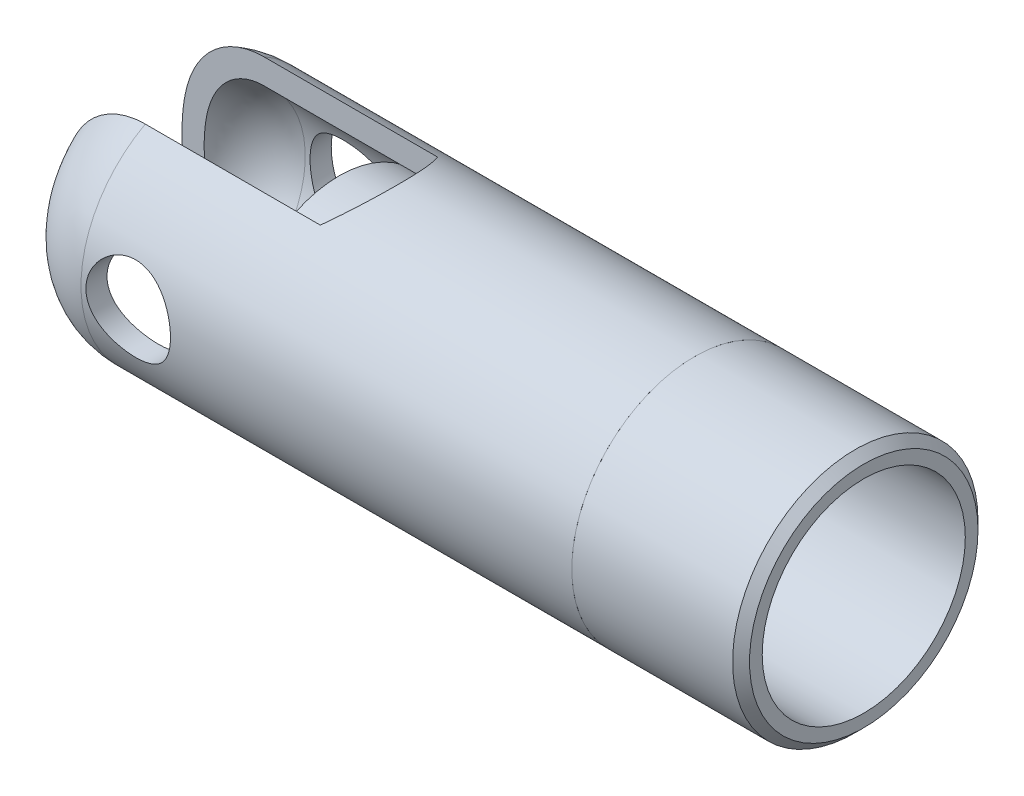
SolidWorks part; units mm, degrees
ref_plane "Alzado" through (0, 0, 0) normal (0, 0, 1) x (1, 0, 0)
ref_plane "Planta" through (0, 0, 0) normal (0, 1, 0) x (1, 0, 0)
ref_plane "Vista lateral" through (0, 0, 0) normal (1, 0, 0) x (0, 0, -1)
sketch "Croquis1" plane through (0, 0, 0) normal (1, 0, 0) x (0, 0, -1)
  circle A0 centre (0, 0) radius 7.25
  circle A1 centre (0, 0) radius 6
extrude "Saliente-Extruir1" add sketch "Croquis1" against normal blind 10
chamfer "Chaflán1" distance 0.5 angle 45 1 edges at (0, 0, -7.25)
sketch "Croquis2" plane through (-10, 0, 0) normal (-1, 0, 0) x (0, 0, 1)
  circle A0 centre (0, 0) radius 6 construction
  circle A1 centre (0, 0) radius 6
extrude "Saliente-Extruir2" add sketch "Croquis2" along normal blind 21 separate body
sketch "Croquis3" plane through (-10, 0, 0) normal (-1, 0, 0) x (0, 0, 1)
  circle A1 centre (0, 0) radius 7.25
  circle A2 centre (0, 0) radius 7.25
  dimension "D1" = 0
extrude "Saliente-Extruir4" add sketch "Croquis3" along normal blind 34 separate body
fillet "Redondeo1" radius 5 1 edges at (-44, 0, 7.25)
shell "Vaciado1" thickness 1.25
sketch "Croquis5" plane through (0, 0, 0) normal (0, 1, 0) x (1, 0, 0)
  line L0 (-10, 7.25) -> (-39, 7.25) construction
  line L1 (-39, -7.25) -> (-10, -7.25) construction
  line L2 (-44, 3.5458) -> (-28.7223, 3.5458)
  line L4 (-44, 3.5458) -> (-44, -3.4536)
  line L6 (-44, -3.4536) -> (-28.6561, -3.4536)
  arc A0 (-28.7223, 3.5458) -> (-28.6561, -3.4536) centre (-33.5625, 0) cw
  dimension "D3" = 6
  dimension "D2" = 7.25
  dimension "D4" = 7.25
extrude "Cortar-Extruir1" cut sketch "Croquis5" against normal mid plane 34
sketch "Croquis6" plane through (0, 0, 0) normal (0, 0, 1) x (1, 0, 0)
  circle A0 centre (-36.2151, 0) radius 2.5
extrude "Cortar-Extruir2" cut sketch "Croquis6" against normal mid plane 34
